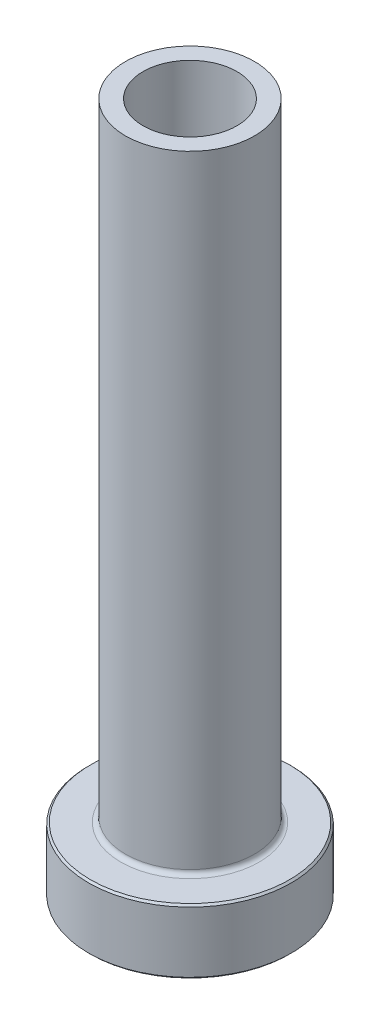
SolidWorks part; units mm, degrees
ref_plane "Front Plane" through (0, 0, 0) normal (0, 0, 1) x (1, 0, 0)
ref_plane "Top Plane" through (0, 0, 0) normal (0, 1, 0) x (1, 0, 0)
ref_plane "Right Plane" through (0, 0, 0) normal (1, 0, 0) x (0, 0, -1)
sketch "Sketch1" plane through (0, 0, 0) normal (0, 0, 1) x (1, 0, 0)
  line L0 (-5.1, 75) -> (-7, 75)
  line L1 (-7, 75) -> (-7, 7)
  line L2 (-7, 7) -> (-11, 7)
  line L3 (-11, 7) -> (-11, 0)
  line L4 (12.1, 0) -> (-12.1, 0) construction
  line L5 (-11, 0) -> (-5.35, 0)
  line L6 (-5.1, 20) -> (-5.1, 75)
  line L7 (0, 92.1877) -> (0, -15.5353) construction
  line L8 (0, -12.1) -> (0, 12.1) construction
  line L9 (-5.1, 20) -> (-5.35, 8)
  line L10 (-5.35, 8) -> (-5.35, 0)
  dimension "D1" = 0.25
  dimension "ID" = 10.2
  dimension "OD" = 14
  dimension "L" = 75
  dimension "H" = 22
  dimension "T" = 7
  dimension "N" = 55
  dimension "D2" = 12
revolve "Revolve1" add sketch "Sketch1" angle 360 about L7
fillet "Fillet1" radius 0.5 1 edges at (0, 7, 7)
chamfer "Chamfer1" distance 0.2 angle 45 2 edges at (0, 7, 11) (0, 0, 11)
chamfer "Chamfer3" distance 0.5 angle 45 1 edges at (0, 0, 5.35)
